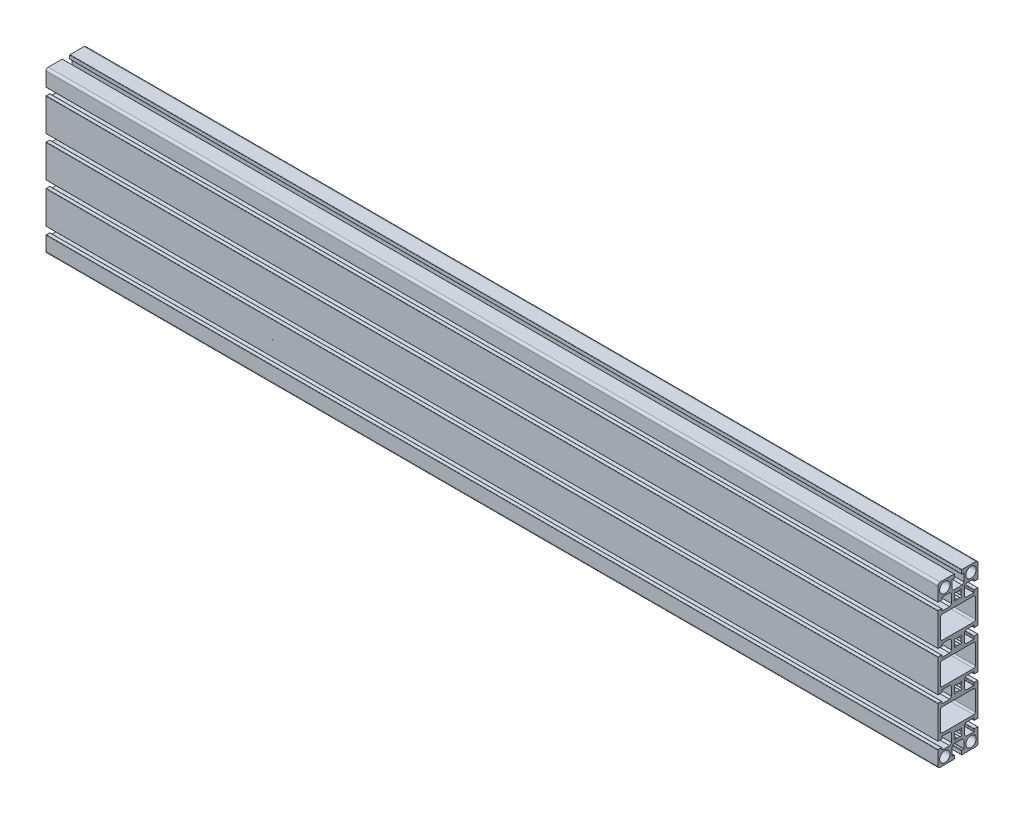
SolidWorks part; units mm, degrees
ref_plane "Front Plane" through (0, 0, 0) normal (0, 0, 1) x (1, 0, 0)
ref_plane "Top Plane" through (0, 0, 0) normal (0, 1, 0) x (1, 0, 0)
ref_plane "Right Plane" through (0, 0, 0) normal (1, 0, 0) x (0, 0, -1)
sketch "Sketch1" plane through (0, 0, 0) normal (0, 0, 1) x (1, 0, 0)
  line L0 (0, 0) -> (1000, 0)
  dimension "D1" = 1000
other "45-sarja 1.0053 45X180(1)"
ref_plane "Plane1" through (0, 0, 0) normal (1, 0, 0) x (0, 0, -1)
sketch "Model13" plane through (0, 0, 0) normal (1, 0, 0) x (0, 0, -1)
  line L0 (-3.0486, 71.876) -> (-4.376, 70.5486)
  line L1 (-4.376, 70.5486) -> (-3.3345, 69.5071)
  line L2 (-3.3345, 65.4929) -> (-4.376, 64.4514)
  line L3 (-4.376, 64.4514) -> (-3.0486, 63.124)
  line L4 (-3.0486, 63.124) -> (-2.0071, 64.1655)
  line L5 (2.0071, 64.1655) -> (3.0486, 63.124)
  line L6 (3.0486, 63.124) -> (4.376, 64.4514)
  line L7 (4.376, 64.4514) -> (3.3345, 65.4929)
  line L8 (3.3345, 69.5071) -> (4.376, 70.5486)
  line L9 (4.376, 70.5486) -> (3.0486, 71.876)
  line L10 (3.0486, 71.876) -> (2.0071, 70.8345)
  line L11 (-2.0071, 70.8345) -> (-3.0486, 71.876)
  line L12 (-17.7, 32.3) -> (17.7, 32.3)
  line L13 (19.5, 34.1) -> (19.5, 55.9)
  line L14 (17.7, 57.7) -> (-17.7, 57.7)
  line L15 (-19.5, 55.9) -> (-19.5, 34.1)
  line L16 (-3.0486, 26.876) -> (-4.376, 25.5486)
  line L17 (-4.376, 25.5486) -> (-3.3345, 24.5071)
  line L18 (-3.3345, 20.4929) -> (-4.376, 19.4514)
  line L19 (-4.376, 19.4514) -> (-3.0486, 18.124)
  line L20 (-3.0486, 18.124) -> (-2.0071, 19.1655)
  line L21 (2.0071, 19.1655) -> (3.0486, 18.124)
  line L22 (3.0486, 18.124) -> (4.376, 19.4514)
  line L23 (4.376, 19.4514) -> (3.3345, 20.4929)
  line L24 (3.3345, 24.5071) -> (4.376, 25.5486)
  line L25 (4.376, 25.5486) -> (3.0486, 26.876)
  line L26 (3.0486, 26.876) -> (2.0071, 25.8345)
  line L27 (-2.0071, 25.8345) -> (-3.0486, 26.876)
  line L28 (19.5, -10.9) -> (19.5, 10.9)
  line L29 (17.7, 12.7) -> (-17.7, 12.7)
  line L30 (-19.5, 10.9) -> (-19.5, -10.9)
  line L31 (-17.7, -12.7) -> (17.7, -12.7)
  line L32 (-3.0486, -18.124) -> (-4.376, -19.4514)
  line L33 (-4.376, -19.4514) -> (-3.3345, -20.4929)
  line L34 (-3.3345, -24.5071) -> (-4.376, -25.5486)
  line L35 (-4.376, -25.5486) -> (-3.0486, -26.876)
  line L36 (-3.0486, -26.876) -> (-2.0071, -25.8345)
  line L37 (2.0071, -25.8345) -> (3.0486, -26.876)
  line L38 (3.0486, -26.876) -> (4.376, -25.5486)
  line L39 (4.376, -25.5486) -> (3.3345, -24.5071)
  line L40 (3.3345, -20.4929) -> (4.376, -19.4514)
  line L41 (4.376, -19.4514) -> (3.0486, -18.124)
  line L42 (3.0486, -18.124) -> (2.0071, -19.1655)
  line L43 (-2.0071, -19.1655) -> (-3.0486, -18.124)
  line L44 (19.5, -55.9) -> (19.5, -34.1)
  line L45 (17.7, -32.3) -> (-17.7, -32.3)
  line L46 (-19.5, -34.1) -> (-19.5, -55.9)
  line L47 (-17.7, -57.7) -> (17.7, -57.7)
  line L48 (-3.0486, -63.124) -> (-4.376, -64.4514)
  line L49 (-4.376, -64.4514) -> (-3.3345, -65.4929)
  line L50 (-3.3345, -69.5071) -> (-4.376, -70.5486)
  line L51 (-4.376, -70.5486) -> (-3.0486, -71.876)
  line L52 (-3.0486, -71.876) -> (-2.0071, -70.8345)
  line L53 (2.0071, -70.8345) -> (3.0486, -71.876)
  line L54 (3.0486, -71.876) -> (4.376, -70.5486)
  line L55 (4.376, -70.5486) -> (3.3345, -69.5071)
  line L56 (3.3345, -65.4929) -> (4.376, -64.4514)
  line L57 (4.376, -64.4514) -> (3.0486, -63.124)
  line L58 (3.0486, -63.124) -> (2.0071, -64.1655)
  line L59 (-2.0071, -64.1655) -> (-3.0486, -63.124)
  line L60 (18.5, -63.4) -> (22.2, -63.4)
  line L61 (18, -61) -> (18, -62.9)
  line L62 (9.2, -60.7) -> (17.7, -60.7)
  line L63 (7.2, -62.7) -> (9.2, -60.7)
  line L64 (7.2, -72.3) -> (7.2, -62.7)
  line L65 (9.2, -74.3) -> (7.2, -72.3)
  line L66 (17.7, -74.3) -> (9.2, -74.3)
  line L67 (18, -72.1) -> (18, -74)
  line L68 (22.2, -71.6) -> (18.5, -71.6)
  line L69 (22.5, -87.5) -> (22.5, -71.9)
  line L70 (4.4, -90) -> (20, -90)
  line L71 (4.1, -86) -> (4.1, -89.7)
  line L72 (6.5, -85.5) -> (4.6, -85.5)
  line L73 (6.8, -76.7) -> (6.8, -85.2)
  line L74 (4.8, -74.7) -> (6.8, -76.7)
  line L75 (-4.8, -74.7) -> (4.8, -74.7)
  line L76 (-6.8, -76.7) -> (-4.8, -74.7)
  line L77 (-6.8, -85.2) -> (-6.8, -76.7)
  line L78 (-4.6, -85.5) -> (-6.5, -85.5)
  line L79 (-4.1, -89.7) -> (-4.1, -86)
  line L80 (-20, -90) -> (-4.4, -90)
  line L81 (-22.5, -71.9) -> (-22.5, -87.5)
  line L82 (-18.5, -71.6) -> (-22.2, -71.6)
  line L83 (-18, -74) -> (-18, -72.1)
  line L84 (-9.2, -74.3) -> (-17.7, -74.3)
  line L85 (-7.2, -72.3) -> (-9.2, -74.3)
  line L86 (-7.2, -62.7) -> (-7.2, -72.3)
  line L87 (-9.2, -60.7) -> (-7.2, -62.7)
  line L88 (-17.7, -60.7) -> (-9.2, -60.7)
  line L89 (-18, -62.9) -> (-18, -61)
  line L90 (-22.2, -63.4) -> (-18.5, -63.4)
  line L91 (-22.5, -26.9) -> (-22.5, -63.1)
  line L92 (-18.5, -26.6) -> (-22.2, -26.6)
  line L93 (-18, -29) -> (-18, -27.1)
  line L94 (-9.2, -29.3) -> (-17.7, -29.3)
  line L95 (-7.2, -27.3) -> (-9.2, -29.3)
  line L96 (-7.2, -17.7) -> (-7.2, -27.3)
  line L97 (-9.2, -15.7) -> (-7.2, -17.7)
  line L98 (-17.7, -15.7) -> (-9.2, -15.7)
  line L99 (-18, -17.9) -> (-18, -16)
  line L100 (-22.2, -18.4) -> (-18.5, -18.4)
  line L101 (-22.5, 18.1) -> (-22.5, -18.1)
  line L102 (-18.5, 18.4) -> (-22.2, 18.4)
  line L103 (-18, 16) -> (-18, 17.9)
  line L104 (-9.2, 15.7) -> (-17.7, 15.7)
  line L105 (-7.2, 17.7) -> (-9.2, 15.7)
  line L106 (-7.2, 27.3) -> (-7.2, 17.7)
  line L107 (-9.2, 29.3) -> (-7.2, 27.3)
  line L108 (-17.7, 29.3) -> (-9.2, 29.3)
  line L109 (-18, 27.1) -> (-18, 29)
  line L110 (-22.2, 26.6) -> (-18.5, 26.6)
  line L111 (-22.5, 63.1) -> (-22.5, 26.9)
  line L112 (-18.5, 63.4) -> (-22.2, 63.4)
  line L113 (-18, 61) -> (-18, 62.9)
  line L114 (-9.2, 60.7) -> (-17.7, 60.7)
  line L115 (-7.2, 62.7) -> (-9.2, 60.7)
  line L116 (-7.2, 72.3) -> (-7.2, 62.7)
  line L117 (-9.2, 74.3) -> (-7.2, 72.3)
  line L118 (-17.7, 74.3) -> (-9.2, 74.3)
  line L119 (-18, 72.1) -> (-18, 74)
  line L120 (-22.2, 71.6) -> (-18.5, 71.6)
  line L121 (-22.5, 87.5) -> (-22.5, 71.9)
  line L122 (-4.4, 90) -> (-20, 90)
  line L123 (-4.1, 86) -> (-4.1, 89.7)
  line L124 (-6.5, 85.5) -> (-4.6, 85.5)
  line L125 (-6.8, 76.7) -> (-6.8, 85.2)
  line L126 (-4.8, 74.7) -> (-6.8, 76.7)
  line L127 (4.8, 74.7) -> (-4.8, 74.7)
  line L128 (6.8, 76.7) -> (4.8, 74.7)
  line L129 (6.8, 85.2) -> (6.8, 76.7)
  line L130 (4.6, 85.5) -> (6.5, 85.5)
  line L131 (4.1, 89.7) -> (4.1, 86)
  line L132 (20, 90) -> (4.4, 90)
  line L133 (22.5, 71.9) -> (22.5, 87.5)
  line L134 (18.5, 71.6) -> (22.2, 71.6)
  line L135 (18, 74) -> (18, 72.1)
  line L136 (9.2, 74.3) -> (17.7, 74.3)
  line L137 (7.2, 72.3) -> (9.2, 74.3)
  line L138 (7.2, 62.7) -> (7.2, 72.3)
  line L139 (9.2, 60.7) -> (7.2, 62.7)
  line L140 (17.7, 60.7) -> (9.2, 60.7)
  line L141 (18, 62.9) -> (18, 61)
  line L142 (22.2, 63.4) -> (18.5, 63.4)
  line L143 (22.5, 26.9) -> (22.5, 63.1)
  line L144 (18.5, 26.6) -> (22.2, 26.6)
  line L145 (18, 29) -> (18, 27.1)
  line L146 (9.2, 29.3) -> (17.7, 29.3)
  line L147 (7.2, 27.3) -> (9.2, 29.3)
  line L148 (7.2, 17.7) -> (7.2, 27.3)
  line L149 (9.2, 15.7) -> (7.2, 17.7)
  line L150 (17.7, 15.7) -> (9.2, 15.7)
  line L151 (18, 17.9) -> (18, 16)
  line L152 (22.2, 18.4) -> (18.5, 18.4)
  line L153 (22.5, -18.1) -> (22.5, 18.1)
  line L154 (18.5, -18.4) -> (22.2, -18.4)
  line L155 (18, -16) -> (18, -17.9)
  line L156 (9.2, -15.7) -> (17.7, -15.7)
  line L157 (7.2, -17.7) -> (9.2, -15.7)
  line L158 (7.2, -27.3) -> (7.2, -17.7)
  line L159 (9.2, -29.3) -> (7.2, -27.3)
  line L160 (17.7, -29.3) -> (9.2, -29.3)
  line L161 (18, -27.1) -> (18, -29)
  line L162 (22.2, -26.6) -> (18.5, -26.6)
  line L163 (22.5, -63.1) -> (22.5, -26.9)
  circle A0 centre (14.65, 82.15) radius 5.85
  circle A1 centre (-14.65, -82.15) radius 5.85
  arc A2 (-3.279, 69.1595) -> (-3.3345, 69.5071) centre (-3.5466, 69.295) ccw
  arc A3 (-3.279, 69.1595) -> (-3.279, 65.8405) centre (0, 67.5) ccw
  arc A4 (-3.3345, 65.4929) -> (-3.279, 65.8405) centre (-3.5466, 65.705) ccw
  arc A5 (-1.6595, 64.221) -> (-2.0071, 64.1655) centre (-1.795, 63.9534) ccw
  arc A6 (-1.6595, 64.221) -> (1.6595, 64.221) centre (0, 67.5) ccw
  arc A7 (2.0071, 64.1655) -> (1.6595, 64.221) centre (1.795, 63.9534) ccw
  arc A8 (3.279, 65.8405) -> (3.3345, 65.4929) centre (3.5466, 65.705) ccw
  arc A9 (3.279, 65.8405) -> (3.279, 69.1595) centre (0, 67.5) ccw
  arc A10 (3.3345, 69.5071) -> (3.279, 69.1595) centre (3.5466, 69.295) ccw
  arc A11 (1.6595, 70.779) -> (2.0071, 70.8345) centre (1.795, 71.0466) ccw
  arc A12 (1.6595, 70.779) -> (-1.6595, 70.779) centre (0, 67.5) ccw
  arc A13 (-2.0071, 70.8345) -> (-1.6595, 70.779) centre (-1.795, 71.0466) ccw
  arc A14 (-19.5, 34.1) -> (-17.7, 32.3) centre (-17.7, 34.1) ccw
  arc A15 (17.7, 32.3) -> (19.5, 34.1) centre (17.7, 34.1) ccw
  arc A16 (19.5, 55.9) -> (17.7, 57.7) centre (17.7, 55.9) ccw
  arc A17 (-17.7, 57.7) -> (-19.5, 55.9) centre (-17.7, 55.9) ccw
  arc A18 (-3.279, 24.1595) -> (-3.3345, 24.5071) centre (-3.5466, 24.295) ccw
  arc A19 (-3.279, 24.1595) -> (-3.279, 20.8405) centre (0, 22.5) ccw
  arc A20 (-3.3345, 20.4929) -> (-3.279, 20.8405) centre (-3.5466, 20.705) ccw
  arc A21 (-1.6595, 19.221) -> (-2.0071, 19.1655) centre (-1.795, 18.9534) ccw
  arc A22 (-1.6595, 19.221) -> (1.6595, 19.221) centre (0, 22.5) ccw
  arc A23 (2.0071, 19.1655) -> (1.6595, 19.221) centre (1.795, 18.9534) ccw
  arc A24 (3.279, 20.8405) -> (3.3345, 20.4929) centre (3.5466, 20.705) ccw
  arc A25 (3.279, 20.8405) -> (3.279, 24.1595) centre (0, 22.5) ccw
  arc A26 (3.3345, 24.5071) -> (3.279, 24.1595) centre (3.5466, 24.295) ccw
  arc A27 (1.6595, 25.779) -> (2.0071, 25.8345) centre (1.795, 26.0466) ccw
  arc A28 (1.6595, 25.779) -> (-1.6595, 25.779) centre (0, 22.5) ccw
  arc A29 (-2.0071, 25.8345) -> (-1.6595, 25.779) centre (-1.795, 26.0466) ccw
  arc A30 (17.7, -12.7) -> (19.5, -10.9) centre (17.7, -10.9) ccw
  arc A31 (19.5, 10.9) -> (17.7, 12.7) centre (17.7, 10.9) ccw
  arc A32 (-17.7, 12.7) -> (-19.5, 10.9) centre (-17.7, 10.9) ccw
  arc A33 (-19.5, -10.9) -> (-17.7, -12.7) centre (-17.7, -10.9) ccw
  arc A34 (-3.279, -20.8405) -> (-3.3345, -20.4929) centre (-3.5466, -20.705) ccw
  arc A35 (-3.279, -20.8405) -> (-3.279, -24.1595) centre (0, -22.5) ccw
  arc A36 (-3.3345, -24.5071) -> (-3.279, -24.1595) centre (-3.5466, -24.295) ccw
  arc A37 (-1.6595, -25.779) -> (-2.0071, -25.8345) centre (-1.795, -26.0466) ccw
  arc A38 (-1.6595, -25.779) -> (1.6595, -25.779) centre (0, -22.5) ccw
  arc A39 (2.0071, -25.8345) -> (1.6595, -25.779) centre (1.795, -26.0466) ccw
  arc A40 (3.279, -24.1595) -> (3.3345, -24.5071) centre (3.5466, -24.295) ccw
  arc A41 (3.279, -24.1595) -> (3.279, -20.8405) centre (0, -22.5) ccw
  arc A42 (3.3345, -20.4929) -> (3.279, -20.8405) centre (3.5466, -20.705) ccw
  arc A43 (1.6595, -19.221) -> (2.0071, -19.1655) centre (1.795, -18.9534) ccw
  arc A44 (1.6595, -19.221) -> (-1.6595, -19.221) centre (0, -22.5) ccw
  arc A45 (-2.0071, -19.1655) -> (-1.6595, -19.221) centre (-1.795, -18.9534) ccw
  arc A46 (17.7, -57.7) -> (19.5, -55.9) centre (17.7, -55.9) ccw
  arc A47 (19.5, -34.1) -> (17.7, -32.3) centre (17.7, -34.1) ccw
  arc A48 (-17.7, -32.3) -> (-19.5, -34.1) centre (-17.7, -34.1) ccw
  arc A49 (-19.5, -55.9) -> (-17.7, -57.7) centre (-17.7, -55.9) ccw
  arc A50 (-3.279, -65.8405) -> (-3.3345, -65.4929) centre (-3.5466, -65.705) ccw
  arc A51 (-3.279, -65.8405) -> (-3.279, -69.1595) centre (0, -67.5) ccw
  arc A52 (-3.3345, -69.5071) -> (-3.279, -69.1595) centre (-3.5466, -69.295) ccw
  arc A53 (-1.6595, -70.779) -> (-2.0071, -70.8345) centre (-1.795, -71.0466) ccw
  arc A54 (-1.6595, -70.779) -> (1.6595, -70.779) centre (0, -67.5) ccw
  arc A55 (2.0071, -70.8345) -> (1.6595, -70.779) centre (1.795, -71.0466) ccw
  arc A56 (3.279, -69.1595) -> (3.3345, -69.5071) centre (3.5466, -69.295) ccw
  arc A57 (3.279, -69.1595) -> (3.279, -65.8405) centre (0, -67.5) ccw
  arc A58 (3.3345, -65.4929) -> (3.279, -65.8405) centre (3.5466, -65.705) ccw
  arc A59 (1.6595, -64.221) -> (2.0071, -64.1655) centre (1.795, -63.9534) ccw
  arc A60 (1.6595, -64.221) -> (-1.6595, -64.221) centre (0, -67.5) ccw
  arc A61 (-2.0071, -64.1655) -> (-1.6595, -64.221) centre (-1.795, -63.9534) ccw
  arc A62 (18, -62.9) -> (18.5, -63.4) centre (18.5, -62.9) ccw
  arc A63 (18, -61) -> (17.7, -60.7) centre (17.7, -61) ccw
  arc A64 (17.7, -74.3) -> (18, -74) centre (17.7, -74) ccw
  arc A65 (18.5, -71.6) -> (18, -72.1) centre (18.5, -72.1) ccw
  arc A66 (22.5, -71.9) -> (22.2, -71.6) centre (22.2, -71.9) ccw
  arc A67 (20, -90) -> (22.5, -87.5) centre (20, -87.5) ccw
  arc A68 (4.1, -89.7) -> (4.4, -90) centre (4.4, -89.7) ccw
  arc A69 (4.6, -85.5) -> (4.1, -86) centre (4.6, -86) ccw
  arc A70 (6.5, -85.5) -> (6.8, -85.2) centre (6.5, -85.2) ccw
  arc A71 (-6.8, -85.2) -> (-6.5, -85.5) centre (-6.5, -85.2) ccw
  arc A72 (-4.1, -86) -> (-4.6, -85.5) centre (-4.6, -86) ccw
  arc A73 (-4.4, -90) -> (-4.1, -89.7) centre (-4.4, -89.7) ccw
  arc A74 (-22.5, -87.5) -> (-20, -90) centre (-20, -87.5) ccw
  arc A75 (-22.2, -71.6) -> (-22.5, -71.9) centre (-22.2, -71.9) ccw
  arc A76 (-18, -72.1) -> (-18.5, -71.6) centre (-18.5, -72.1) ccw
  arc A77 (-18, -74) -> (-17.7, -74.3) centre (-17.7, -74) ccw
  arc A78 (-17.7, -60.7) -> (-18, -61) centre (-17.7, -61) ccw
  arc A79 (-18.5, -63.4) -> (-18, -62.9) centre (-18.5, -62.9) ccw
  arc A80 (-22.5, -63.1) -> (-22.2, -63.4) centre (-22.2, -63.1) ccw
  arc A81 (-22.2, -26.6) -> (-22.5, -26.9) centre (-22.2, -26.9) ccw
  arc A82 (-18, -27.1) -> (-18.5, -26.6) centre (-18.5, -27.1) ccw
  arc A83 (-18, -29) -> (-17.7, -29.3) centre (-17.7, -29) ccw
  arc A84 (-17.7, -15.7) -> (-18, -16) centre (-17.7, -16) ccw
  arc A85 (-18.5, -18.4) -> (-18, -17.9) centre (-18.5, -17.9) ccw
  arc A86 (-22.5, -18.1) -> (-22.2, -18.4) centre (-22.2, -18.1) ccw
  arc A87 (-22.2, 18.4) -> (-22.5, 18.1) centre (-22.2, 18.1) ccw
  arc A88 (-18, 17.9) -> (-18.5, 18.4) centre (-18.5, 17.9) ccw
  arc A89 (-18, 16) -> (-17.7, 15.7) centre (-17.7, 16) ccw
  arc A90 (-17.7, 29.3) -> (-18, 29) centre (-17.7, 29) ccw
  arc A91 (-18.5, 26.6) -> (-18, 27.1) centre (-18.5, 27.1) ccw
  arc A92 (-22.5, 26.9) -> (-22.2, 26.6) centre (-22.2, 26.9) ccw
  arc A93 (-22.2, 63.4) -> (-22.5, 63.1) centre (-22.2, 63.1) ccw
  arc A94 (-18, 62.9) -> (-18.5, 63.4) centre (-18.5, 62.9) ccw
  arc A95 (-18, 61) -> (-17.7, 60.7) centre (-17.7, 61) ccw
  arc A96 (-17.7, 74.3) -> (-18, 74) centre (-17.7, 74) ccw
  arc A97 (-18.5, 71.6) -> (-18, 72.1) centre (-18.5, 72.1) ccw
  arc A98 (-22.5, 71.9) -> (-22.2, 71.6) centre (-22.2, 71.9) ccw
  arc A99 (-20, 90) -> (-22.5, 87.5) centre (-20, 87.5) ccw
  arc A100 (-4.1, 89.7) -> (-4.4, 90) centre (-4.4, 89.7) ccw
  arc A101 (-4.6, 85.5) -> (-4.1, 86) centre (-4.6, 86) ccw
  arc A102 (-6.5, 85.5) -> (-6.8, 85.2) centre (-6.5, 85.2) ccw
  arc A103 (6.8, 85.2) -> (6.5, 85.5) centre (6.5, 85.2) ccw
  arc A104 (4.1, 86) -> (4.6, 85.5) centre (4.6, 86) ccw
  arc A105 (4.4, 90) -> (4.1, 89.7) centre (4.4, 89.7) ccw
  arc A106 (22.5, 87.5) -> (20, 90) centre (20, 87.5) ccw
  arc A107 (22.2, 71.6) -> (22.5, 71.9) centre (22.2, 71.9) ccw
  arc A108 (18, 72.1) -> (18.5, 71.6) centre (18.5, 72.1) ccw
  arc A109 (18, 74) -> (17.7, 74.3) centre (17.7, 74) ccw
  arc A110 (17.7, 60.7) -> (18, 61) centre (17.7, 61) ccw
  arc A111 (18.5, 63.4) -> (18, 62.9) centre (18.5, 62.9) ccw
  arc A112 (22.5, 63.1) -> (22.2, 63.4) centre (22.2, 63.1) ccw
  arc A113 (22.2, 26.6) -> (22.5, 26.9) centre (22.2, 26.9) ccw
  arc A114 (18, 27.1) -> (18.5, 26.6) centre (18.5, 27.1) ccw
  arc A115 (18, 29) -> (17.7, 29.3) centre (17.7, 29) ccw
  arc A116 (17.7, 15.7) -> (18, 16) centre (17.7, 16) ccw
  arc A117 (18.5, 18.4) -> (18, 17.9) centre (18.5, 17.9) ccw
  arc A118 (22.5, 18.1) -> (22.2, 18.4) centre (22.2, 18.1) ccw
  arc A119 (22.2, -18.4) -> (22.5, -18.1) centre (22.2, -18.1) ccw
  arc A120 (18, -17.9) -> (18.5, -18.4) centre (18.5, -17.9) ccw
  arc A121 (18, -16) -> (17.7, -15.7) centre (17.7, -16) ccw
  arc A122 (17.7, -29.3) -> (18, -29) centre (17.7, -29) ccw
  arc A123 (18.5, -26.6) -> (18, -27.1) centre (18.5, -27.1) ccw
  arc A124 (22.5, -26.9) -> (22.2, -26.6) centre (22.2, -26.9) ccw
  arc A125 (22.2, -63.4) -> (22.5, -63.1) centre (22.2, -63.1) ccw
  circle A126 centre (14.65, -82.15) radius 5.85
  circle A127 centre (-14.65, 82.15) radius 5.85
  point P408 (0, 67.5)
  point P409 (0, 22.5)
  point P410 (0, 0)
  point P411 (-22.5, 0)
  point P412 (22.5, 0)
  point P413 (22.5, 45)
  point P414 (-22.5, 45)
  point P415 (0, -22.5)
  point P416 (22.5, -45)
  point P417 (-22.5, -45)
  point P418 (0, -67.5)
  point P419 (-22.5, 90)
  point P420 (22.5, 90)
  point P421 (-22.5, -90)
  point P422 (22.5, -90)
  point P423 (0, 0)
